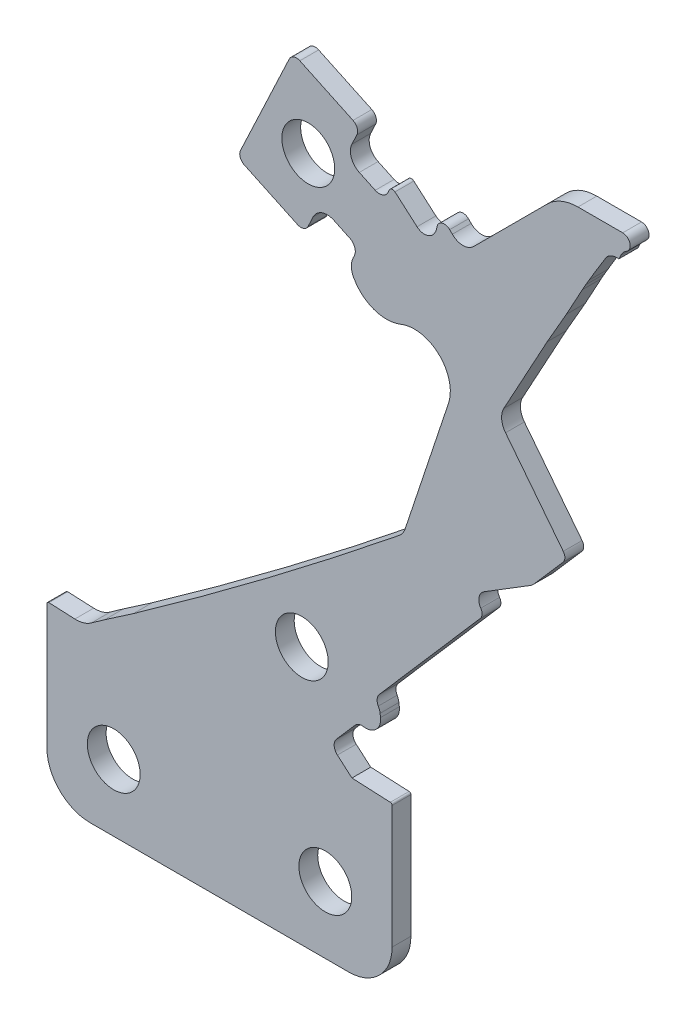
SolidWorks part; units mm, degrees
ref_plane "Front" through (0, 0, 0) normal (0, 0, 1) x (1, 0, 0)
ref_plane "Top" through (0, 0, 0) normal (0, 1, 0) x (1, 0, 0)
ref_plane "Right" through (0, 0, 0) normal (1, 0, 0) x (0, 0, -1)
sketch "Sketch1" plane through (0, 0, 0) normal (0, 0, 1) x (1, 0, 0)
  line L62 (-360.4002, -2.9337) -> (-359.7243, -1.4972)
  line L63 (-360.2414, -0.0608) -> (-367.4235, 3.3187)
  line L64 (-368.8599, 2.8015) -> (-375.4379, -11.1778)
  line L65 (-374.9207, -12.6142) -> (-367.7386, -15.9937)
  line L66 (-366.3022, -15.4765) -> (-365.6263, -14.0401)
  line L67 (-362.8381, -13.0362) -> (-360.6834, -14.0501)
  line L68 (-360.0598, -15.7822) -> (-360.2288, -16.1413)
  line L69 (-347.3511, -26.7133) -> (-353.2058, -44.3225)
  line L70 (-389.903, -72.5709) -> (-393.7788, -75.223)
  line L71 (-397.8031, -77.1519) -> (-401.308, -76.9867)
  line L73 (-401.574, -77.2405) -> (-401.574, -94.107)
  line L74 (-395.732, -99.949) -> (-360.807, -99.949)
  line L75 (-354.965, -94.107) -> (-354.965, -77.5397)
  line L76 (-355.207, -77.286) -> (-360.39, -77.0417)
  line L77 (-360.39, -77.0417) -> (-362.3524, -75.3375)
  line L78 (-362.4786, -73.5459) -> (-359.9832, -70.6725)
  line L79 (-356.5305, -68.0449) -> (-356.5876, -67.5736)
  line L80 (-356.6751, -65.3914) -> (-343.0665, -49.7211)
  line L81 (-342.5342, -46.3286) -> (-336.3539, -42.5154)
  line L82 (-335.7406, -41.9944) -> (-331.8842, -37.5537)
  line L83 (-331.851, -36.2616) -> (-339.6463, -26.2941)
  line L84 (-339.8717, -23.5466) -> (-334.0182, -12.8325)
  line L85 (-334.0182, -12.8325) -> (-331.4358, -8.3355)
  line L86 (-331.4358, -8.3355) -> (-329.2676, -4.367)
  line L116 (-323.8215, 5.0008) -> (-329.8669, 5.0008)
  line L117 (-333.9978, 3.2897) -> (-343.9584, -6.6709)
  line L118 (-346.832, -6.6709) -> (-347.1912, -6.3117)
  line L119 (-349.398, -7.9691) -> (-349.4462, -8.0247)
  line L120 (-351.5962, -8.1761) -> (-354.5728, -5.5911)
  line L121 (-355.3406, -5.7531) -> (-355.5096, -6.1122)
  line L122 (-357.2417, -6.7358) -> (-359.3963, -5.7219)
  line L123 (-360.4002, -2.9337) -> (-359.7243, -1.4972)
  line L124 (-360.2414, -0.0608) -> (-367.4235, 3.3187)
  line L125 (-368.8599, 2.8015) -> (-375.4379, -11.1778)
  line L126 (-374.9207, -12.6142) -> (-367.7386, -15.9937)
  line L127 (-366.3022, -15.4765) -> (-365.6263, -14.0401)
  line L128 (-362.8381, -13.0362) -> (-360.6834, -14.0501)
  line L129 (-360.0598, -15.7822) -> (-360.2288, -16.1413)
  line L130 (-347.3511, -26.7133) -> (-353.2058, -44.3225)
  line L131 (-389.903, -72.5709) -> (-393.7788, -75.223)
  line L132 (-397.8031, -77.1519) -> (-401.308, -76.9867)
  line L133 (-401.574, -77.2405) -> (-401.574, -94.107)
  line L134 (-395.732, -99.949) -> (-360.807, -99.949)
  line L135 (-354.965, -94.107) -> (-354.965, -77.5397)
  line L136 (-355.207, -77.286) -> (-360.39, -77.0417)
  line L137 (-360.39, -77.0417) -> (-362.3524, -75.3375)
  line L138 (-362.4786, -73.5459) -> (-359.9832, -70.6725)
  line L139 (-356.5305, -68.0449) -> (-356.5876, -67.5736)
  line L140 (-356.6751, -65.3914) -> (-343.0665, -49.7211)
  line L141 (-342.5342, -46.3286) -> (-336.3539, -42.5154)
  line L142 (-335.7406, -41.9944) -> (-331.8842, -37.5537)
  line L143 (-331.851, -36.2616) -> (-339.6463, -26.2941)
  line L144 (-339.8717, -23.5466) -> (-334.0182, -12.8325)
  line L145 (-334.0182, -12.8325) -> (-331.4358, -8.3355)
  line L146 (-331.4358, -8.3355) -> (-329.2676, -4.367)
  line L147 (-323.8215, 5.0008) -> (-329.8669, 5.0008)
  line L148 (-333.9978, 3.2897) -> (-343.9584, -6.6709)
  line L149 (-346.832, -6.6709) -> (-347.1912, -6.3117)
  line L150 (-349.398, -7.9691) -> (-349.4462, -8.0247)
  line L151 (-351.5962, -8.1761) -> (-354.5728, -5.5911)
  line L152 (-355.3406, -5.7531) -> (-355.5096, -6.1122)
  line L153 (-357.2417, -6.7358) -> (-359.3963, -5.7219)
  arc A88 (-359.7243, -1.4972) -> (-360.2414, -0.0608) centre (-360.7011, -1.0376) ccw
  arc A89 (-367.4235, 3.3187) -> (-368.8599, 2.8015) centre (-367.8832, 2.3419) ccw
  arc A120 (-375.4379, -11.1778) -> (-374.9207, -12.6142) centre (-374.4611, -11.6374) ccw
  arc A121 (-367.7386, -15.9937) -> (-366.3022, -15.4765) centre (-367.279, -15.0169) ccw
  arc A122 (-362.8381, -13.0362) -> (-365.6263, -14.0401) centre (-363.7303, -14.9323) ccw
  arc A123 (-360.0598, -15.7822) -> (-360.6834, -14.0501) centre (-361.2377, -15.228) ccw
  arc A124 (-360.2288, -16.1413) -> (-360.1767, -18.3644) centre (-357.9773, -17.2007) ccw
  arc A125 (-360.1767, -18.3644) -> (-353.7957, -20.6824) centre (-355.7059, -15.999) ccw
  arc A126 (-347.3511, -26.7133) -> (-353.7957, -20.6824) centre (-351.961, -25.1806) ccw
  arc A127 (-354.0115, -45.4835) -> (-353.2058, -44.3225) centre (-355.5857, -43.5312) ccw
  arc A128 (-389.903, -72.5709) -> (-354.0115, -45.4835) centre (-793.7243, 499.8274) ccw
  arc A129 (-393.7788, -75.223) -> (-395.5713, -76.4953) centre (-95.1891, -497.8086) ccw
  arc A130 (-397.8031, -77.1519) -> (-395.5713, -76.4953) centre (-397.6357, -73.5999) ccw
  arc A131 (-401.308, -76.9867) -> (-401.574, -77.2405) centre (-401.32, -77.2405) ccw
  arc A132 (-401.574, -94.107) -> (-395.732, -99.949) centre (-395.732, -94.107) ccw
  arc A133 (-360.807, -99.949) -> (-354.965, -94.107) centre (-360.807, -94.107) ccw
  arc A134 (-354.965, -77.5397) -> (-355.207, -77.286) centre (-355.219, -77.5397) ccw
  arc A135 (-362.4786, -73.5459) -> (-362.3524, -75.3375) centre (-361.5197, -74.3786) ccw
  arc A136 (-358.8233, -70.2512) -> (-359.9832, -70.6725) centre (-359.0244, -71.5052) ccw
  arc A137 (-358.8233, -70.2512) -> (-356.5305, -68.0449) centre (-358.5081, -68.2843) ccw
  arc A138 (-356.5876, -67.5736) -> (-356.8254, -66.8427) centre (-358.5651, -67.813) ccw
  arc A139 (-356.6751, -65.3914) -> (-356.8254, -66.8427) centre (-355.7162, -66.2241) ccw
  arc A140 (-343.0665, -49.7211) -> (-342.9938, -48.4832) centre (-343.8336, -49.0549) ccw
  arc A141 (-342.5342, -46.3286) -> (-342.9938, -48.4832) centre (-341.734, -47.6256) ccw
  arc A142 (-336.3539, -42.5154) -> (-335.7406, -41.9944) centre (-337.7543, -40.2457) ccw
  arc A143 (-331.8842, -37.5537) -> (-331.851, -36.2616) centre (-332.6513, -36.8875) ccw
  arc A144 (-339.8717, -23.5466) -> (-339.6463, -26.2941) centre (-337.6707, -24.7491) ccw
  arc A145 (-328.8286, -3.5852) -> (-329.2676, -4.367) centre (-246.2982, -50.4461) ccw
  arc A146 (-328.3704, -2.812) -> (-328.8286, -3.5852) centre (-295.3841, -22.8808) ccw
  arc A147 (-326.0963, 0.9258) -> (-328.3704, -2.812) centre (-213.8052, -69.9538) ccw
  arc A148 (-325.5442, 1.4442) -> (-326.0963, 0.9258) centre (-324.8211, 0.1209) ccw
  arc A149 (-324.3751, 1.6964) -> (-325.5442, 1.4442) centre (-324.5334, -0.4056) ccw
  arc A150 (-324.3751, 1.6964) -> (-324.2951, 1.7446) centre (-324.369, 1.7768) ccw
  arc A151 (-324.0878, 2.2136) -> (-324.2951, 1.7446) centre (-274.8211, -19.8428) ccw
  arc A152 (-323.292, 3.1176) -> (-324.0878, 2.2136) centre (-322.2331, 1.3833) ccw
  arc A153 (-323.292, 3.1176) -> (-323.8215, 5.0008) centre (-323.8215, 3.9848) ccw
  arc A154 (-329.8669, 5.0008) -> (-333.9978, 3.2897) centre (-329.8669, -0.8412) ccw
  arc A155 (-346.832, -6.6709) -> (-343.9584, -6.6709) centre (-345.3952, -5.234) ccw
  arc A156 (-347.1912, -6.3117) -> (-348.9172, -6.899) centre (-347.9097, -7.0301) ccw
  arc A157 (-349.398, -7.9691) -> (-348.9172, -6.899) centre (-350.9322, -6.6367) ccw
  arc A158 (-351.5962, -8.1761) -> (-349.4462, -8.0247) centre (-350.5969, -7.0254) ccw
  arc A159 (-354.5728, -5.5911) -> (-355.3406, -5.7531) centre (-354.8954, -5.9625) ccw
  arc A160 (-357.2417, -6.7358) -> (-355.5096, -6.1122) centre (-356.6874, -5.5579) ccw
  arc A161 (-360.4002, -2.9337) -> (-359.3963, -5.7219) centre (-358.5041, -3.8258) ccw
  arc A162 (-359.7243, -1.4972) -> (-360.2414, -0.0608) centre (-360.7011, -1.0376) ccw
  arc A163 (-367.4235, 3.3187) -> (-368.8599, 2.8015) centre (-367.8832, 2.3419) ccw
  arc A164 (-375.4379, -11.1778) -> (-374.9207, -12.6142) centre (-374.4611, -11.6374) ccw
  arc A165 (-367.7386, -15.9937) -> (-366.3022, -15.4765) centre (-367.279, -15.0169) ccw
  arc A166 (-362.8381, -13.0362) -> (-365.6263, -14.0401) centre (-363.7303, -14.9323) ccw
  arc A167 (-360.0598, -15.7822) -> (-360.6834, -14.0501) centre (-361.2377, -15.228) ccw
  arc A168 (-360.2288, -16.1413) -> (-360.1767, -18.3644) centre (-357.9773, -17.2007) ccw
  arc A169 (-360.1767, -18.3644) -> (-353.7957, -20.6824) centre (-355.7059, -15.999) ccw
  arc A170 (-347.3511, -26.7133) -> (-353.7957, -20.6824) centre (-351.961, -25.1806) ccw
  arc A171 (-354.0115, -45.4835) -> (-353.2058, -44.3225) centre (-355.5857, -43.5312) ccw
  arc A172 (-389.903, -72.5709) -> (-354.0115, -45.4835) centre (-793.7243, 499.8274) ccw
  arc A173 (-393.7788, -75.223) -> (-395.5713, -76.4953) centre (-95.1891, -497.8086) ccw
  arc A174 (-397.8031, -77.1519) -> (-395.5713, -76.4953) centre (-397.6357, -73.5999) ccw
  arc A175 (-401.308, -76.9867) -> (-401.574, -77.2405) centre (-401.32, -77.2405) ccw
  arc A176 (-401.574, -94.107) -> (-395.732, -99.949) centre (-395.732, -94.107) ccw
  arc A177 (-360.807, -99.949) -> (-354.965, -94.107) centre (-360.807, -94.107) ccw
  arc A178 (-354.965, -77.5397) -> (-355.207, -77.286) centre (-355.219, -77.5397) ccw
  arc A179 (-362.4786, -73.5459) -> (-362.3524, -75.3375) centre (-361.5197, -74.3786) ccw
  arc A180 (-358.8233, -70.2512) -> (-359.9832, -70.6725) centre (-359.0244, -71.5052) ccw
  arc A181 (-358.8233, -70.2512) -> (-356.5305, -68.0449) centre (-358.5081, -68.2843) ccw
  arc A182 (-356.5876, -67.5736) -> (-356.8254, -66.8427) centre (-358.5651, -67.813) ccw
  arc A183 (-356.6751, -65.3914) -> (-356.8254, -66.8427) centre (-355.7162, -66.2241) ccw
  arc A184 (-343.0665, -49.7211) -> (-342.9938, -48.4832) centre (-343.8336, -49.0549) ccw
  arc A185 (-342.5342, -46.3286) -> (-342.9938, -48.4832) centre (-341.734, -47.6256) ccw
  arc A186 (-336.3539, -42.5154) -> (-335.7406, -41.9944) centre (-337.7543, -40.2457) ccw
  arc A187 (-331.8842, -37.5537) -> (-331.851, -36.2616) centre (-332.6513, -36.8875) ccw
  arc A188 (-339.8717, -23.5466) -> (-339.6463, -26.2941) centre (-337.6707, -24.7491) ccw
  arc A189 (-328.8286, -3.5852) -> (-329.2676, -4.367) centre (-246.2982, -50.4461) ccw
  arc A190 (-328.3704, -2.812) -> (-328.8286, -3.5852) centre (-295.3841, -22.8808) ccw
  arc A191 (-326.0963, 0.9258) -> (-328.3704, -2.812) centre (-213.8052, -69.9538) ccw
  arc A192 (-325.5442, 1.4442) -> (-326.0963, 0.9258) centre (-324.8211, 0.1209) ccw
  arc A193 (-324.3751, 1.6964) -> (-325.5442, 1.4442) centre (-324.5334, -0.4056) ccw
  arc A194 (-324.3751, 1.6964) -> (-324.2951, 1.7446) centre (-324.369, 1.7768) ccw
  arc A195 (-324.0878, 2.2136) -> (-324.2951, 1.7446) centre (-274.8211, -19.8428) ccw
  arc A196 (-323.292, 3.1176) -> (-324.0878, 2.2136) centre (-322.2331, 1.3833) ccw
  arc A197 (-323.292, 3.1176) -> (-323.8215, 5.0008) centre (-323.8215, 3.9848) ccw
  arc A198 (-329.8669, 5.0008) -> (-333.9978, 3.2897) centre (-329.8669, -0.8412) ccw
  arc A199 (-346.832, -6.6709) -> (-343.9584, -6.6709) centre (-345.3952, -5.234) ccw
  arc A200 (-347.1912, -6.3117) -> (-348.9172, -6.899) centre (-347.9097, -7.0301) ccw
  arc A201 (-349.398, -7.9691) -> (-348.9172, -6.899) centre (-350.9322, -6.6367) ccw
  arc A202 (-351.5962, -8.1761) -> (-349.4462, -8.0247) centre (-350.5969, -7.0254) ccw
  arc A203 (-354.5728, -5.5911) -> (-355.3406, -5.7531) centre (-354.8954, -5.9625) ccw
  arc A204 (-357.2417, -6.7358) -> (-355.5096, -6.1122) centre (-356.6874, -5.5579) ccw
  arc A205 (-360.4002, -2.9337) -> (-359.3963, -5.7219) centre (-358.5041, -3.8258) ccw
  dimension "D1" = 0.508
extrude "Boss-Extrude1" add sketch "Sketch1" along normal blind 2.54 separate body
hole_wizard "Hole1" positions "Point_Sketch" profile "Profil_Sketch" hole size "Ø0.15" standard "ISO"
sketch "Point_Sketch" plane through (-363.5027, -54.4864, 0) normal (0, 0, 1) x (-1, 0, 0)
  point P0 (3.6543, 10.6011)
  point P2 (29.0543, 36.4456)
  point P4 (0.4793, 36.4456)
sketch "Profil_Sketch" plane through (-367.157, -65.0875, 0) normal (1, 0, 0) x (0, 1, 0)
  line L0 (0, 0) -> (0, 2.54)
  line L1 (0, 2.54) -> (3.5687, 2.54)
  line L2 (3.5687, 2.54) -> (3.5687, 0)
  line L5 (3.5687, 0) -> (0, 0)
  line L11 (0, -6.35) -> (0, 107.95) construction
  dimension "Diameter" = 7.1374
  dimension "Thru Hole Depth" = 2.54
other "usin_DL090_.25-20x3-SHCS<1>"
hole_wizard "Hole11" positions "Point_Sketch1" profile "Profil_Sketch1" hole size "Ø0.15" standard "ISO"
sketch "Point_Sketch1" plane through (-362.6341, 3.6553, 0) normal (0, 0, 1) x (-1, 0, 0)
  point P0 (3.6543, 10.6011)
sketch "Profil_Sketch1" plane through (-366.2883, -6.9458, 0) normal (1, 0, 0) x (0, 1, 0)
  line L0 (0, 0) -> (0, 2.54)
  line L1 (0, 2.54) -> (3.5687, 2.54)
  line L2 (3.5687, 2.54) -> (3.5687, 0)
  line L5 (3.5687, 0) -> (0, 0)
  line L11 (0, -6.35) -> (0, 107.95) construction
  dimension "Diameter" = 7.1374
  dimension "Thru Hole Depth" = 2.54
other "usin_DL090_.25-20x1.5-SHCS<2>"
